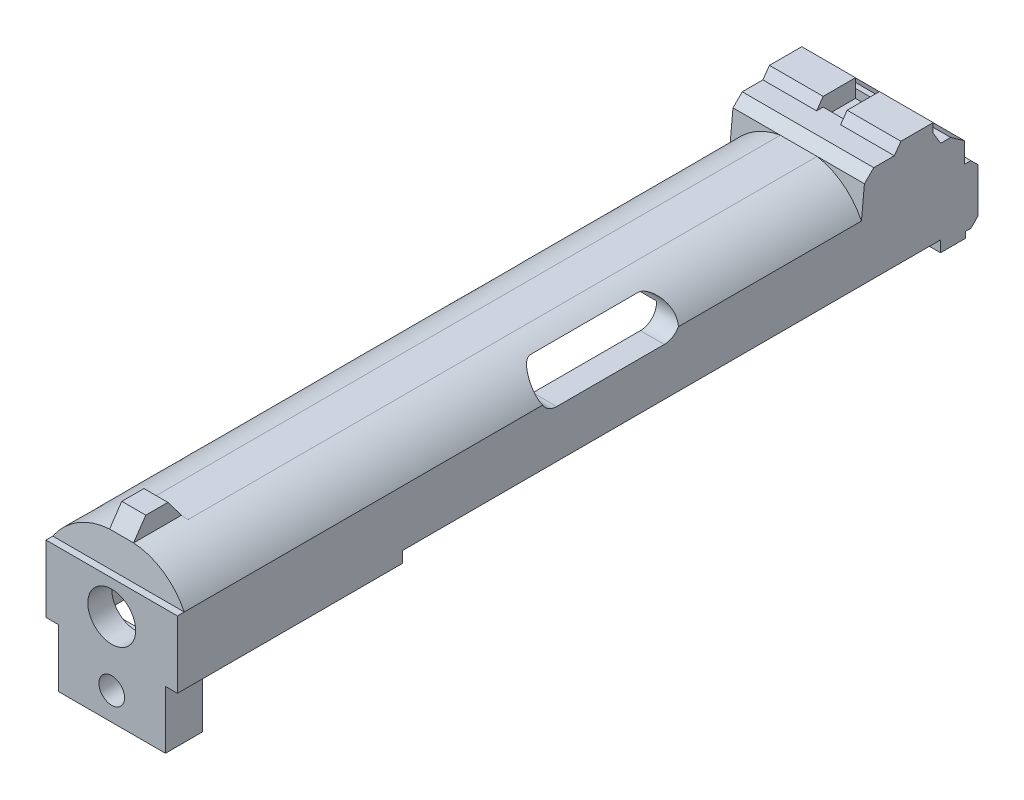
SolidWorks part; units mm, degrees
ref_plane "Front Plane" through (0, 0, 0) normal (0, 0, 1) x (1, 0, 0)
ref_plane "Top Plane" through (0, 0, 0) normal (0, 1, 0) x (1, 0, 0)
ref_plane "Right Plane" through (0, 0, 0) normal (1, 0, 0) x (0, 0, -1)
sketch "Sketch1" plane through (0, 0, 0) normal (1, 0, 0) x (0, 0, -1)
  line L1 (-81.3962, 92.8377) -> (-248.2614, 92.8377)
  line L2 (-248.2614, 92.8377) -> (-248.2614, 107.0838)
  line L3 (-248.2614, 107.0838) -> (-246.8127, 107.0838)
  line L4 (-246.8127, 107.0838) -> (-245.797, 117.5789)
  line L5 (-245.797, 117.5789) -> (-235.979, 117.5789)
  line L6 (-235.979, 117.5789) -> (-235.979, 113.6291)
  line L7 (-235.979, 113.6291) -> (-102.2445, 113.6291)
  line L8 (-102.2445, 113.6291) -> (-100.2696, 115.604)
  line L9 (-100.2696, 115.604) -> (-95.8874, 115.604)
  line L10 (-95.8874, 115.604) -> (-94.4941, 117.5789)
  line L11 (-94.4941, 117.5789) -> (-87.6206, 117.5789)
  line L12 (-87.6206, 117.5789) -> (-87.6206, 115.604)
  line L13 (-87.6206, 115.604) -> (-86.0415, 112.9802)
  line L14 (-86.0415, 112.9802) -> (-83.9052, 112.9802)
  line L15 (-83.9052, 112.9802) -> (-80.9869, 110.9214)
  line L16 (-80.9869, 110.9214) -> (-80.9869, 106.5706)
  line L17 (-80.9869, 106.5706) -> (-79.6145, 106.5706)
  line L18 (-79.6145, 106.5706) -> (-78.1039, 105.0601)
  line L19 (-78.1039, 105.0601) -> (-78.1039, 95.6164)
  line L20 (-78.1039, 95.6164) -> (-79.6145, 94.1058)
  line L21 (-79.6145, 94.1058) -> (-80.7463, 94.1058)
  line L22 (-80.7463, 94.1058) -> (-80.7463, 92.8377)
  line L23 (-80.7463, 92.8377) -> (-81.3962, 92.8377)
  dimension "D1" = 78.1039
  dimension "D2" = 79.6145
  dimension "D3" = 80.7463
  dimension "D4" = 80.9869
  dimension "D5" = 81.3962
  dimension "D6" = 83.9052
  dimension "D7" = 86.0415
  dimension "D8" = 87.6206
  dimension "D9" = 94.4941
  dimension "D10" = 95.8874
  dimension "D11" = 100.2696
  dimension "D12" = 102.2445
  dimension "D13" = 235.979
  dimension "D14" = 245.797
  dimension "D15" = 246.8127
  dimension "D16" = 248.2614
  dimension "D17" = 92.8377
  dimension "D18" = 94.1058
  dimension "D19" = 105.0601
  dimension "D20" = 110.9214
  dimension "D21" = 112.9802
  dimension "D22" = 107.0838
  dimension "D23" = 113.6291
extrude "Boss-Extrude1" add sketch "Sketch1" along normal blind 27.94
sketch "Sketch3" plane through (0, 92.8377, 0) normal (0, -1, 0) x (1, 0, 0)
  line L8 (5.08, 243.1814) -> (5.08, 85.8263)
  line L9 (5.08, 85.8263) -> (22.86, 85.8263)
  line L10 (22.86, 85.8263) -> (22.86, 243.1814)
  line L11 (22.86, 243.1814) -> (5.08, 243.1814)
  line L12 (5.08, 243.1814) -> (5.08, 85.8263)
  line L13 (5.08, 85.8263) -> (22.86, 85.8263)
  line L14 (22.86, 85.8263) -> (22.86, 243.1814)
  line L15 (22.86, 243.1814) -> (5.08, 243.1814)
  dimension "D1" = 5.08
extrude "Cut-Extrude1" cut sketch "Sketch3" against normal blind 16.256
sketch "Sketch4" plane through (0, 0, 248.2614) normal (0, 0, 1) x (1, 0, 0)
  circle A0 centre (13.97, 99.9608) radius 5.08
  dimension "D1" = 10.16
extrude "Cut-Extrude2" cut sketch "Sketch4" against normal blind 16.256
sketch "Sketch6" plane through (0, 117.5789, 0) normal (0, 1, 0) x (1, 0, 0)
  line L0 (11.4209, -87.6206) -> (11.4209, -94.4941)
  line L1 (11.4209, -87.6206) -> (16.5191, -87.6206)
  line L2 (11.4209, -94.4941) -> (16.5191, -94.4941)
  line L3 (16.5191, -87.6206) -> (16.5191, -94.4941)
  line L4 (11.4209, -87.6206) -> (16.5191, -94.4941) construction
  line L5 (11.4209, -94.4941) -> (16.5191, -87.6206) construction
  line L6 (27.94, -87.6206) -> (0, -87.6206) construction
  line L8 (27.94, -94.4941) -> (0, -94.4941) construction
  line L9 (0, -87.6206) -> (0, -94.4941) construction
  line L10 (11.4209, -245.797) -> (0, -245.797)
  line L12 (27.94, -245.797) -> (0, -245.797) construction
  line L13 (0, -245.797) -> (0, -235.979)
  line L14 (11.4209, -245.797) -> (11.4209, -235.979)
  line L15 (0, -235.979) -> (11.4209, -235.979)
  line L16 (27.94, -235.979) -> (0, -235.979) construction
  line L17 (16.5191, -235.979) -> (16.5191, -245.797)
  line L18 (27.94, -245.797) -> (27.94, -235.979)
  line L19 (27.94, -235.979) -> (16.5191, -235.979)
  line L20 (16.5191, -245.797) -> (27.94, -245.797)
  point P1 (13.97, -91.0573)
  dimension "D1" = 11.4209
  dimension "D2" = 13.97
extrude "Cut-Extrude4" cut sketch "Sketch6" against normal blind 3.81
sketch "Sketch7" plane through (0, 0, 248.2614) normal (0, 0, 1) x (1, 0, 0)
  line L0 (11.4209, 117.5789) -> (11.4209, 113.7689)
  line L1 (11.4209, 113.7689) -> (0, 113.6291)
  line L2 (0, 113.6291) -> (0, 117.5789)
  line L3 (0, 117.5789) -> (11.4209, 117.5789)
  line L4 (16.5191, 117.5789) -> (27.94, 117.5789)
  line L5 (27.94, 117.5789) -> (27.94, 113.7689)
  line L6 (27.94, 113.7689) -> (16.5191, 113.7689)
  line L7 (16.5191, 113.7689) -> (16.5191, 117.5789)
extrude "Cut-Extrude5" cut sketch "Sketch7" against normal blind 18.034
sketch "Sketch8" plane through (0, 24.657, 254.7895) normal (0, 0.0963, 0.9954) x (1, 0, 0)
  line L0 (27.94, 82.8118) -> (0, 82.8118) construction
  line L1 (0, 89.3877) -> (0, 82.8118) construction
  line L2 (11.4209, 89.5281) -> (0, 89.3877)
  line L4 (0, 89.3877) -> (0, 82.8118)
  line L5 (16.5191, 89.5281) -> (27.94, 89.5281)
  line L6 (27.94, 89.5281) -> (27.94, 82.8118)
  arc A0 (0, 82.8118) -> (11.4209, 89.5281) centre (12.2325, 75.0794) cw
  arc A1 (27.94, 82.8118) -> (16.5191, 89.5281) centre (15.7075, 75.0794) ccw
extrude "Cut-Extrude6" cut sketch "Sketch8" along direction (0, 0, 1) on the side against the normal up to vertex (143.2655 mm away)
sketch "Sketch10" plane through (0, 83.5854, 118.4766) normal (0, 0.5765, 0.8171) x (1, 0, 0)
  line L0 (11.4209, 41.6019) -> (11.4209, 39.185)
  line L1 (27.94, 39.185) -> (0, 39.185) construction
  line L2 (11.4209, 39.185) -> (16.5191, 39.185)
  line L3 (16.5191, 39.185) -> (16.5191, 41.6019)
  line L4 (16.5191, 41.6019) -> (11.4209, 41.6019)
extrude "Cut-Extrude7" cut sketch "Sketch10" along direction (0, 0, -1) on the side against the normal blind 140.462
sketch "Sketch11" plane through (16.5191, 0, 0) normal (1, 0, 0) x (0, 0, -1)
  line L0 (-246.1657, 113.7689) -> (-243.5732, 117.5789)
  line L1 (-235.979, 117.5789) -> (-245.797, 117.5789) construction
  line L2 (-243.5732, 117.5789) -> (-245.797, 117.5789)
  line L3 (-245.797, 117.5789) -> (-246.1657, 113.7689)
  line L4 (-238.8681, 117.5789) -> (-235.979, 113.7689)
  line L5 (-235.979, 113.7689) -> (-235.979, 117.5789) construction
  line L6 (-235.979, 113.7689) -> (-246.1657, 113.7689) construction
  line L7 (-235.979, 113.7689) -> (-235.979, 117.5789)
  line L8 (-235.979, 117.5789) -> (-238.8681, 117.5789)
extrude "Cut-Extrude8" cut sketch "Sketch11" against normal blind 140.462
sketch "Sketch13" plane through (27.94, 0, 0) normal (1, 0, 0) x (0, 0, -1)
sketch "Sketch14" plane through (27.94, 0, 0) normal (1, 0, 0) x (0, 0, -1)
  line L4 (-167.6383, 108.7378) -> (-144.7783, 108.7378) construction
  line L5 (-167.6383, 112.1553) -> (-144.7783, 112.1553)
  line L6 (-167.6383, 105.3202) -> (-144.7783, 105.3202)
  arc A2 (-167.6383, 112.1553) -> (-167.6383, 105.3202) centre (-167.6383, 108.7378) ccw
  arc A3 (-144.7783, 105.3202) -> (-144.7783, 112.1553) centre (-144.7783, 108.7378) ccw
  point P12 (-156.2083, 108.7378)
extrude "Cut-Extrude9" cut sketch "Sketch14" against normal blind 11.938
sketch "Sketch17" plane through (0, 0, 248.2614) normal (0, 0, 1) x (1, 0, 0)
sketch3d "3DSketch2"
  line L0 (0, 92.8377, 248.2614) -> (0, 92.8377, 80.7463) construction
  line L3 (27.94, 92.8377, 248.2614) -> (0, 92.8377, 248.2614) construction
  line L4 (13.97, 80.5187, 248.2614) -> (2.6479, 80.5187, 248.2614)
  line L5 (13.97, 80.5187, 248.2614) -> (25.388, 80.5187, 248.2614)
  line L6 (25.388, 80.5187, 248.2614) -> (25.388, 92.8377, 248.2614)
  line L7 (2.6479, 80.5187, 248.2614) -> (2.6479, 92.8377, 248.2614)
  line L8 (2.6479, 92.8377, 248.2614) -> (25.388, 92.8377, 248.2614)
extrude "Boss-Extrude2" add sketch "3DSketch2" along direction (0, 0, -1) on the side against the normal blind 7.874
sketch "Sketch21" plane through (0, 0, 240.3874) normal (0, 0, -1) x (-1, 0, 0)
  circle A0 centre (-13.97, 87.1735) radius 1.905
  dimension "D2" = 3.81
extrude "Boss-Extrude3" add sketch "Sketch21" along normal blind 8.128
sketch "Sketch22" plane through (0, 0, 248.2614) normal (0, 0, 1) x (1, 0, 0)
  circle A0 centre (13.97, 86.3718) radius 2.7305
  dimension "D2" = 5.461
extrude "Cut-Extrude10" cut sketch "Sketch22" against normal up to next
sketch "Sketch24" plane through (0, 0, 0) normal (-1, 0, 0) x (0, 0, 1)
  line L1 (86.0779, 95.2013) -> (200.3779, 95.2013)
  line L2 (200.3779, 92.8377) -> (86.0779, 92.8377)
  line L3 (86.0779, 92.8377) -> (86.0779, 95.2013)
  line L4 (200.3779, 95.2013) -> (200.3779, 92.8377)
  dimension "D1" = 114.3
extrude "Cut-Extrude11" cut sketch "Sketch24" against normal blind 64.77
